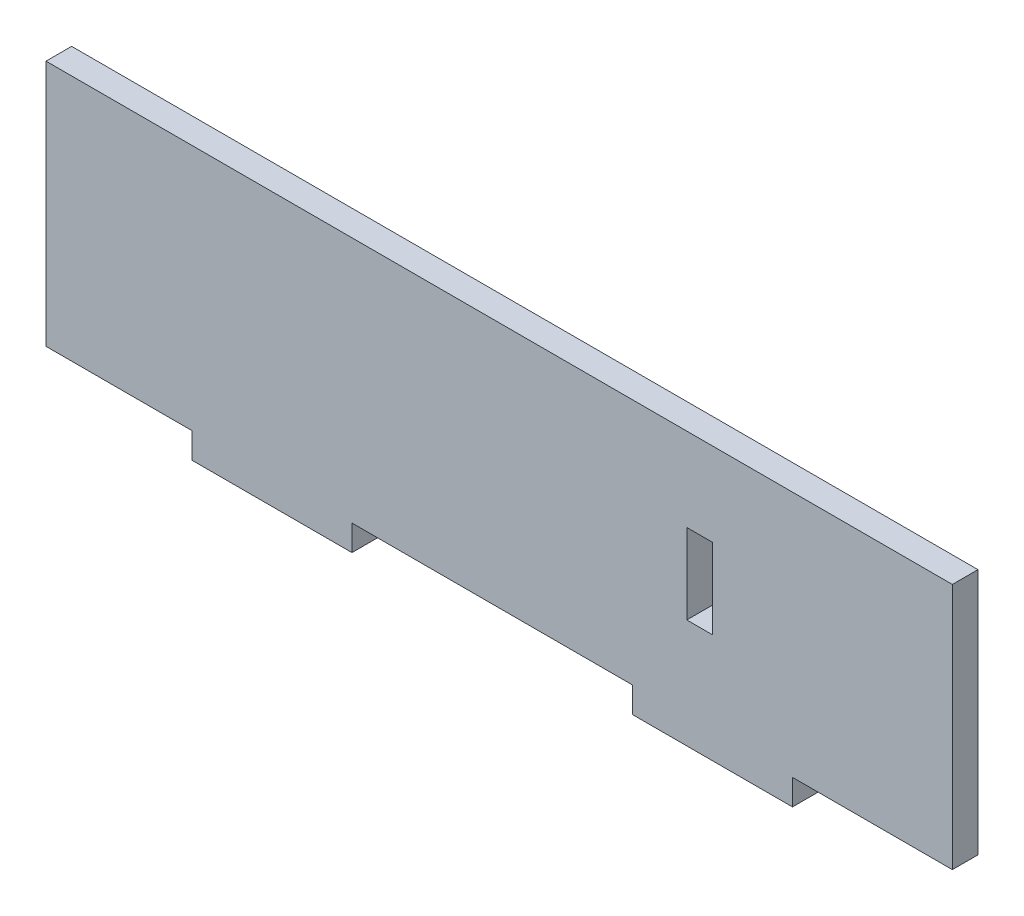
SolidWorks part; units mm, degrees
ref_plane "Front Plane" through (0, 0, 0) normal (0, 0, 1) x (1, 0, 0)
ref_plane "Top Plane" through (0, 0, 0) normal (0, 1, 0) x (1, 0, 0)
ref_plane "Right Plane" through (0, 0, 0) normal (1, 0, 0) x (0, 0, -1)
sketch "Sketch1" plane through (0, 0, 0) normal (0, 0, 1) x (1, 0, 0)
  line L0 (9, 3.3857) -> (100, 3.3857) construction
  line L1 (9, 3.3857) -> (100, 3.3857)
  line L2 (9, 80.4857) -> (409, 80.4857) construction
  line L3 (9, 157.5857) -> (574.8, 157.5857)
  line L5 (409, 105.4857) -> (425, 105.4857)
  line L6 (475, 3.3857) -> (574.8, 3.3857)
  line L7 (100, 3.3857) -> (100, -12.6143)
  line L8 (100, -12.6143) -> (200, -12.6143)
  line L9 (200, 3.3857) -> (200, -12.6143)
  line L10 (574.8, 157.5857) -> (574.8, 3.3857)
  line L11 (9, 157.5857) -> (9, 3.3857)
  line L12 (409, 105.4857) -> (409, 55.4857)
  line L13 (409, 55.4857) -> (425, 55.4857)
  line L14 (200, 3.3857) -> (375, 3.3857)
  line L15 (425, 105.4857) -> (425, 55.4857)
  line L16 (375, 3.3857) -> (375, -12.6143)
  line L17 (375, -12.6143) -> (475, -12.6143)
  line L18 (475, 3.3857) -> (475, -12.6143)
  point P11 (409, 80.4857)
extrude "Boss-Extrude1" add sketch "Sketch1" along normal blind 16
equation "\"thk\"= 16mm"
equation "\"D4@Sketch1\"=\"thk\""
equation "\"D1@Boss-Extrude1\"=\"thk\""
equation "\"D2@Sketch1\"=\"thk\""
